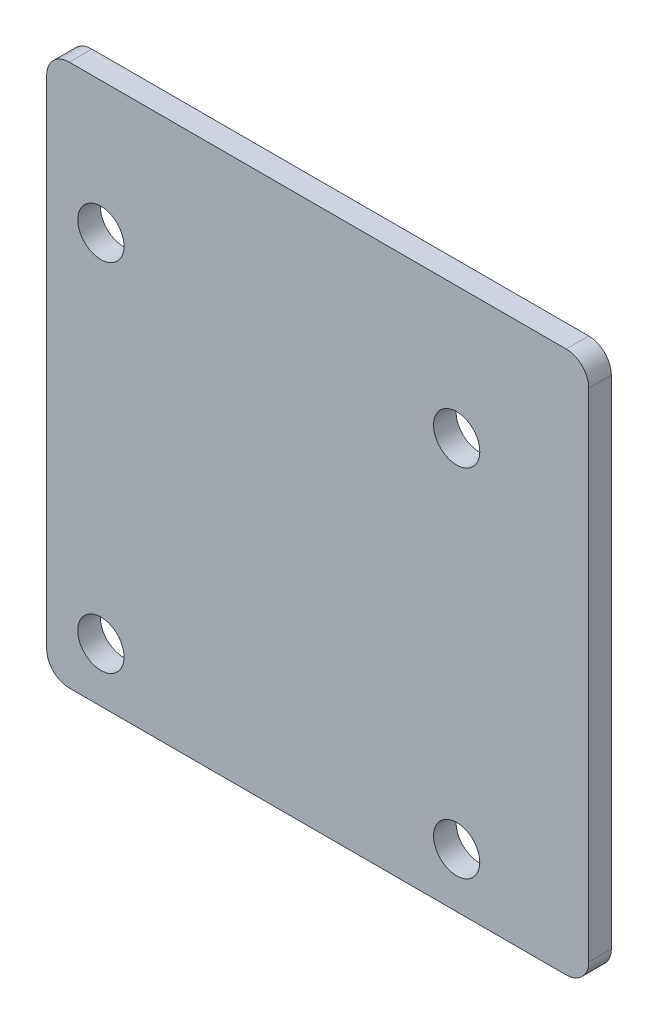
SolidWorks part; units mm, degrees
ref_plane "Front" through (0, 0, 0) normal (0, 0, 1) x (1, 0, 0)
ref_plane "Top" through (0, 0, 0) normal (0, 1, 0) x (1, 0, 0)
ref_plane "Right" through (0, 0, 0) normal (1, 0, 0) x (0, 0, -1)
sketch "Sketch4" plane through (0, 0, 0) normal (0, 0, -1) x (-1, 0, 0)
  line L1 (3.175, -38.1) -> (73.025, -38.1)
  line L2 (0, -34.925) -> (0, 34.925)
  line L3 (3.175, 38.1) -> (73.025, 38.1)
  line L4 (76.2, -34.925) -> (76.2, 34.925)
  arc A0 (76.2, 34.925) -> (73.025, 38.1) centre (73.025, 34.925) ccw
  arc A1 (73.025, -38.1) -> (76.2, -34.925) centre (73.025, -34.925) ccw
  arc A2 (0, -34.925) -> (3.175, -38.1) centre (3.175, -34.925) ccw
  arc A3 (0, 34.925) -> (3.175, 38.1) centre (3.175, 34.925) cw
  point P9 (76.2, -38.1)
  point P12 (0, -38.1)
  point P15 (0, 38.1)
  dimension "D3" = 3.175
  dimension "D1" = 76.2
  dimension "D2" = 76.2
extrude "Extrude4" add sketch "Sketch4" along normal blind 3.175 separate body
hole_wizard "E (0.25) Diameter Hole1" positions "Sketch6" profile "Sketch5" hole size "E" standard "Ansi Inch"
sketch "Sketch6" plane through (0, 0, 0) normal (0, 0, 1) x (1, 0, 0)
  line L0 (-76.2, -34.925) -> (-76.2, 34.925) construction
  line L1 (-3.175, -38.1) -> (-73.025, -38.1) construction
  point P0 (-18.5674, -30.48)
  point P1 (-18.5674, 19.5326)
  point P3 (-68.58, 19.5326)
  point P5 (-68.58, -30.48)
  dimension "D1" = 50.0126
  dimension "D2" = 7.62
  dimension "D3" = 7.62
  dimension "D4" = 50.0126
sketch "Sketch5" plane through (-18.5674, -30.48, 0) normal (1, 0, 0) x (0, -1, 0)
  line L0 (0, 0) -> (0, 3.175)
  line L1 (0, 3.175) -> (3.2512, 3.175)
  line L2 (3.2512, 3.175) -> (3.2512, 0)
  line L5 (3.2512, 0) -> (0, 0)
  line L11 (0, -6.35) -> (0, 107.95) construction
  dimension "Thru Hole Dia." = 6.5024
  dimension "Thru Hole Depth" = 3.175
